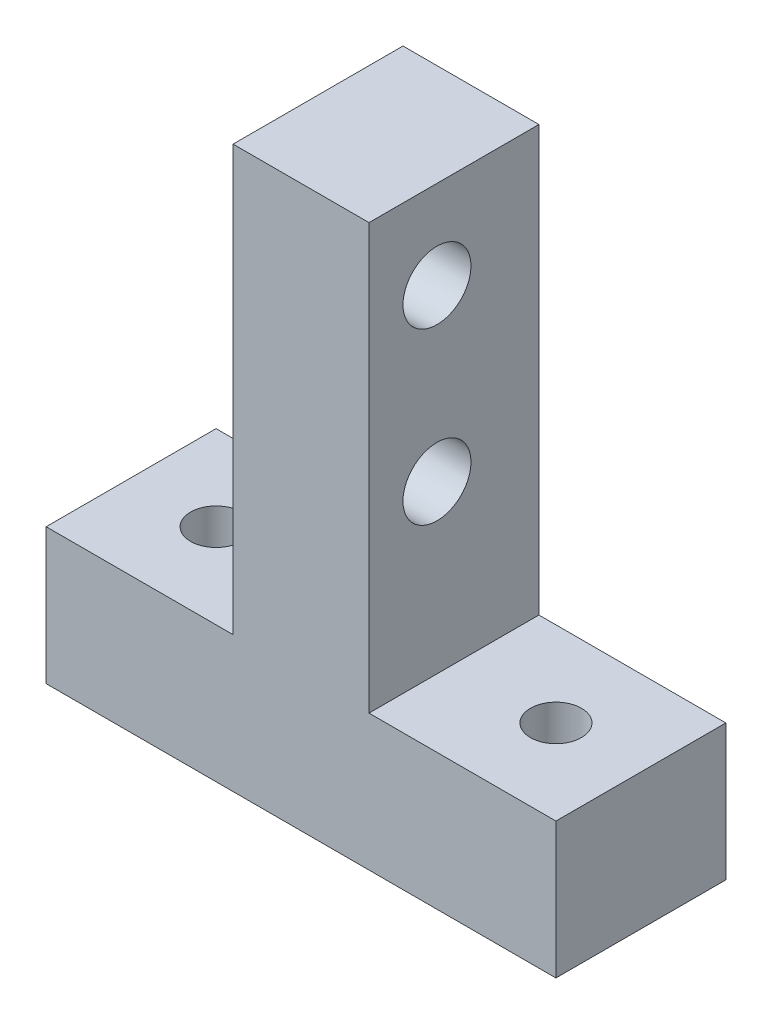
SolidWorks part; units mm, degrees
ref_plane "Front Plane" through (0, 0, 0) normal (0, 0, 1) x (1, 0, 0)
ref_plane "Top Plane" through (0, 0, 0) normal (0, 1, 0) x (1, 0, 0)
ref_plane "Right Plane" through (0, 0, 0) normal (1, 0, 0) x (0, 0, -1)
sketch "Sketch1" plane through (0, 0, 0) normal (0, 1, 0) x (1, 0, 0)
  line L1 (-15, 5) -> (15, 5)
  line L2 (-15, 5) -> (-15, -5)
  line L3 (-15, -5) -> (15, -5)
  line L4 (15, 5) -> (15, -5)
  line L5 (-15, 5) -> (15, -5) construction
  line L6 (-15, -5) -> (15, 5) construction
  point P0 (0, 0)
  dimension "D1" = 10
  dimension "D2" = 30
extrude "Boss-Extrude1" add sketch "Sketch1" along normal blind 8
sketch "Sketch2" plane through (0, 8, 0) normal (0, 1, 0) x (1, 0, 0)
  line L0 (-15, -5) -> (15, -5) construction
  line L1 (-4, 5) -> (4, 5)
  line L2 (-4, 5) -> (-4, -5)
  line L3 (-4, -5) -> (4, -5)
  line L4 (4, 5) -> (4, -5)
  line L5 (-4, 5) -> (4, -5) construction
  line L6 (-4, -5) -> (4, 5) construction
  point P0 (0, 0)
  dimension "D1" = 8
extrude "Boss-Extrude2" add sketch "Sketch2" along normal blind 25
sketch "Sketch3" plane through (0, 8, 0) normal (0, 1, 0) x (1, 0, 0)
  line L0 (-13.836, 0) -> (13.677, 0) construction
  line L3 (10, 3.969) -> (10, -7.32) construction
  line L6 (-10, 4.289) -> (-10, -10.3475) construction
  line L9 (-15, 5) -> (-15, -5) construction
  circle A0 centre (10, 0) radius 1.5
  circle A1 centre (-10, 0) radius 1.5
  dimension "D1" = 3
  dimension "D2" = 20
  dimension "D3" = 5
extrude "Cut-Extrude1" cut sketch "Sketch3" against normal up to next
sketch "Sketch4" plane through (-4, 0, 0) normal (-1, 0, 0) x (0, 0, 1)
  line L0 (1, 32.2277) -> (1, 10.7174) construction
  line L3 (-5, 33) -> (5, 33) construction
  line L4 (5, 33) -> (5, 8) construction
  circle A0 centre (1, 27.8) radius 2
  circle A1 centre (1, 17.8) radius 2
  dimension "D1" = 4
  dimension "D2" = 10
  dimension "D3" = 5.2
  dimension "D4" = 4
extrude "Cut-Extrude2" cut sketch "Sketch4" against normal up to next
